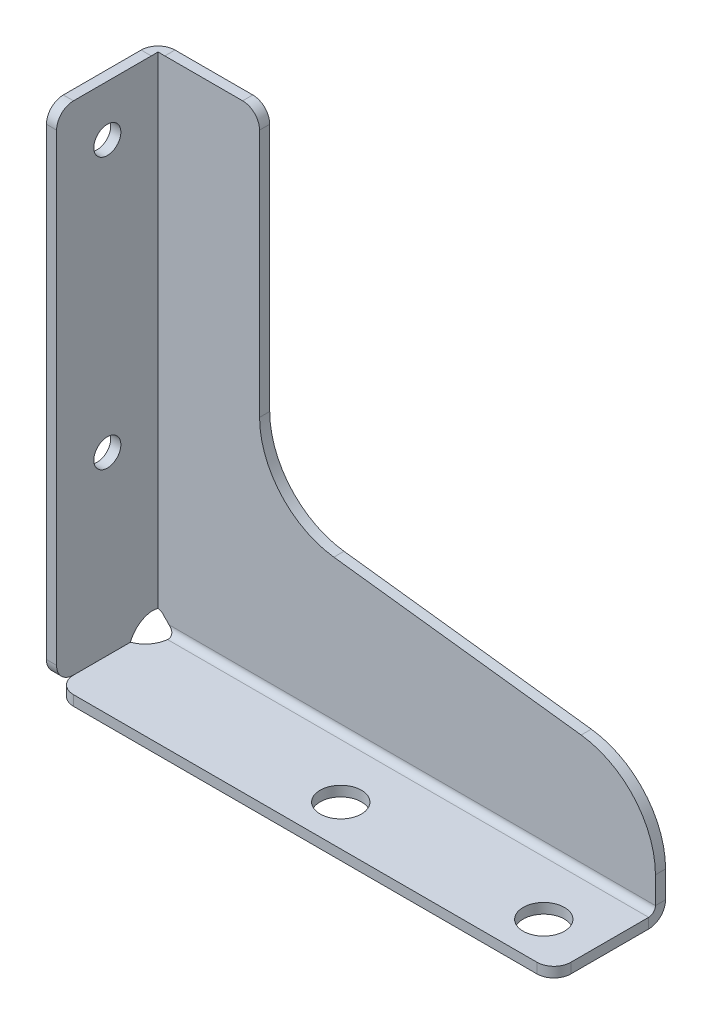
SolidWorks part; units mm, degrees
ref_plane "正面" through (0, 0, 0) normal (0, 0, 1) x (1, 0, 0)
ref_plane "平面" through (0, 0, 0) normal (0, 1, 0) x (1, 0, 0)
ref_plane "右側面" through (0, 0, 0) normal (1, 0, 0) x (0, 0, -1)
sketch "ｽｹｯﾁ1" plane through (0, 0, 0) normal (0, 0, 1) x (1, 0, 0)
  line L0 (114.2253, 30.6675) -> (41.1318, 39.6422)
  line L1 (-42.3215, 142.9719) -> (19.1785, 142.9719)
  line L2 (-10.8215, -35.5281) -> (-10.8215, -13.6953)
  line L3 (136.1785, 5.8538) -> (136.1785, -35.5281)
  line L4 (-42.3215, 142.9719) -> (-42.3215, -4.0281)
  line L5 (-42.3215, -4.0281) -> (-20.4887, -4.0281)
  line L6 (19.1785, 142.9719) -> (19.1785, 64.4559)
  line L9 (-10.8215, -35.5281) -> (136.1785, -35.5281)
  line L10 (-42.3215, -4.0281) -> (19.1785, -4.0281) construction
  arc A0 (41.1318, 39.6422) -> (19.1785, 64.4559) centre (44.1785, 64.4559) cw
  arc A1 (136.1785, 5.8538) -> (114.2253, 30.6675) centre (111.1785, 5.8538) ccw
  arc A2 (-10.8215, -13.6953) -> (-20.4887, -4.0281) centre (-13.4731, -6.6797) ccw
  dimension "D1" = 31.5
  dimension "D8" = 97
  dimension "D10" = 25
  dimension "D3" = 25
  dimension "D2" = 147
  dimension "D4" = 31.5
  dimension "D5" = 61.5
  dimension "D6" = 147
sheet metal parameters "板金1" thickness 3 parameters "D1"=0.7366
base flange "ﾍﾞｰｽ-ﾌﾗﾝｼﾞ1" sketch "ｽｹｯﾁ1" thickness 3 reverse thickness direction yes parameters "D1"=0.7366
sketch "ｽｹｯﾁ13" plane through (0, 0, 3) normal (0, 0, -1) x (-1, 0, 0)
  line L2 (10.8215, -13.6953) -> (10.8215, -35.5281) construction
  line L3 (12.3215, 123.4829) -> (12.3215, 41.897)
  dimension "D1" = 1.5
sketched bend "ｽｹｯﾁ ﾍﾞﾝﾄﾞ1" parameters "D1"=2
bend "ｽｹｯﾁﾍﾞﾝﾄﾞ3" bend radius 2 bend angle 90 parameters "D5"=3
sketch "ｽｹｯﾁ14" plane through (4.4978, 0, 3) normal (0, 0, -1) x (-1, 0, 0)
  line L1 (9.1853, -5.5281) -> (-128.3526, -5.5281)
  line L2 (15.3215, -4.0281) -> (18.3215, -4.0281) construction
  dimension "D1" = 1.5
sketched bend "ｽｹｯﾁ ﾍﾞﾝﾄﾞ2" parameters "D1"=2
bend "ｽｹｯﾁﾍﾞﾝﾄﾞ2" bend radius 2 bend angle 90 parameters "D5"=2
hole_wizard "Ø12.2 (12.2) 直径の穴1" positions "3Dｽｹｯﾁ1" profile "ｽｹｯﾁ8" hole size "Ø12.2" standard "Jis"
sketch3d "3Dｽｹｯﾁ1"
  line L2 (-10.8215, -7.0303, 33) -> (136.1785, -7.0303, 33) construction
  line L3 (136.1785, -7.0303, 33) -> (136.1785, -7.0303, 5) construction
  point P30 (61.1785, -7.0303, 21)
  point P32 (121.1785, -7.0303, 21)
  dimension "D1" = 12
  dimension "D2" = 15
  dimension "D3" = 60
sketch "ｽｹｯﾁ8" plane through (61.1785, -7.0303, 21) normal (1, 0, 0) x (0, 0, -1)
  line L0 (0, 0) -> (0, 39.6652)
  line L1 (0, 39.6652) -> (6.1, 36)
  line L2 (6.1, 36) -> (6.1, 0)
  line L5 (6.1, 0) -> (0, 0)
  line L10 (0, 39.6652) -> (-6.1, 36) construction
  line L11 (0, -6.35) -> (0, 107.95) construction
  dimension "穴の直径" = 12.2
  dimension "穴の深さ" = 36
  dimension "ﾄﾞﾘﾙ角度" = 118
hole_wizard "Ø8.0 (8) 直径の穴1" positions "ｽｹｯﾁ16" profile "ｽｹｯﾁ15" hole size "Ø8.0" standard "Jis"
sketch "ｽｹｯﾁ16" plane through (-13.8237, 0, 0) normal (-1, 0, 0) x (0, 0, 1)
  line L0 (33, 142.9719) -> (33, -4.0281) construction
  line L1 (5, 142.9719) -> (33, 142.9719) construction
  point P0 (18, 127.9719)
  point P2 (18, 47.9719)
  dimension "D1" = 15
  dimension "D2" = 15
  dimension "D3" = 80
sketch "ｽｹｯﾁ15" plane through (-13.8237, 127.9719, 18) normal (0, 1, 0) x (0, 0, 1)
  line L0 (0, 0) -> (0, 38.4034)
  line L1 (0, 38.4034) -> (4, 36)
  line L2 (4, 36) -> (4, 0)
  line L5 (4, 0) -> (0, 0)
  line L10 (0, 38.4034) -> (-4, 36) construction
  line L11 (0, -6.35) -> (0, 107.95) construction
  dimension "穴の直径" = 8
  dimension "穴の深さ" = 36
  dimension "ﾄﾞﾘﾙ角度" = 118
fillet "ﾌｨﾚｯﾄ1" radius 5 5 edges at (136.1785, -5.5303, 33) (-10.8215, -5.5303, 33) (-12.3237, -4.0281, 33) (19.1785, 142.9719, 1.5) (-12.3237, 142.9719, 33)
sketch "ｽｹｯﾁ17" plane through (0, 142.9719, 0) normal (0, 1, 0) x (1, 0, 0)
  line L0 (-8.8237, -3) -> (-10.8237, -3)
  line L1 (-10.8237, -5) -> (-10.8237, -3)
  arc A0 (-8.8237, -3) -> (-10.8237, -5) centre (-8.8237, -5) ccw construction
  arc A1 (-8.8237, -3) -> (-10.8237, -5) centre (-8.8237, -5) ccw
extrude "ｶｯﾄ - 押し出し1" cut sketch "ｽｹｯﾁ17" against normal up to next
flat pattern "ﾌﾗｯﾄ-ﾊﾟﾀｰﾝ1"
sketch "ﾍﾞﾝﾄﾞ-ﾗｲﾝ1" plane through (0, 0, 0) normal (0, 1, 0) x (-1, 0, 0)
bend of the flat pattern "ﾌﾗｯﾄ-<ｽｹｯﾁﾍﾞﾝﾄﾞ2>1"
bend of the flat pattern "ﾌﾗｯﾄ-<ｽｹｯﾁﾍﾞﾝﾄﾞ3>1"
